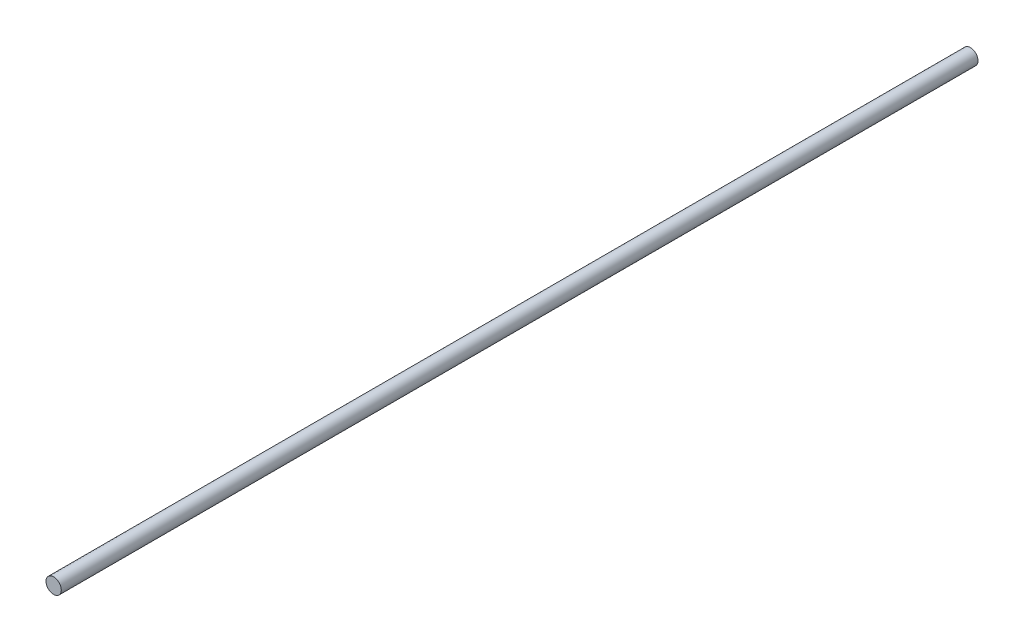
SolidWorks part; units mm, degrees
ref_plane "Front Plane" through (0, 0, 0) normal (0, 0, 1) x (1, 0, 0)
ref_plane "Top Plane" through (0, 0, 0) normal (0, 1, 0) x (1, 0, 0)
ref_plane "Right Plane" through (0, 0, 0) normal (1, 0, 0) x (0, 0, -1)
sketch "Sketch1" plane through (0, 0, 0) normal (0, 0, 1) x (1, 0, 0)
  circle A0 centre (0, 0) radius 1.5
  dimension "D1" = 3
extrude "Boss-Extrude1" add sketch "Sketch1" along normal mid plane 180
